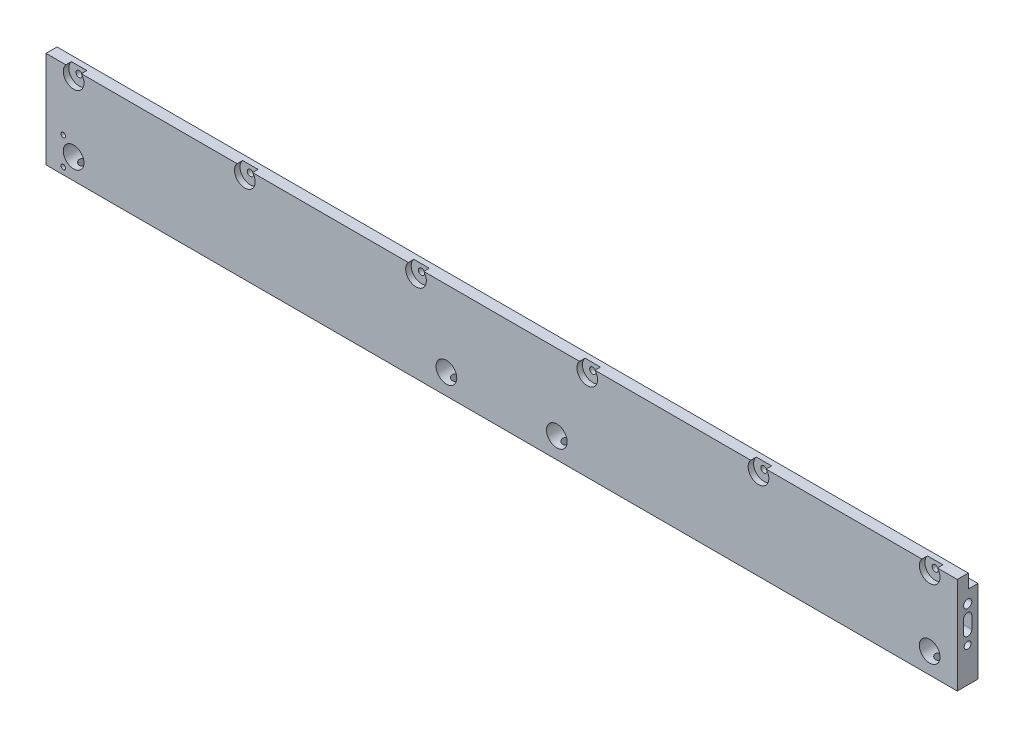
SolidWorks part; units mm, degrees
ref_plane "Plan de face" through (0, 0, 0) normal (0, 0, 1) x (1, 0, 0)
ref_plane "Plan de dessus" through (0, 0, 0) normal (0, 1, 0) x (1, 0, 0)
ref_plane "Plan de droite" through (0, 0, 0) normal (1, 0, 0) x (0, 0, -1)
sketch "Esquisse1" plane through (0, 0, 0) normal (1, 0, 0) x (0, 0, -1)
  line L0 (0, 0) -> (0, 70)
  line L1 (0, 70) -> (8, 70)
  line L2 (8, 70) -> (8, 60)
  line L3 (8, 60) -> (15, 60)
  line L4 (15, 60) -> (15, 0)
  line L5 (15, 0) -> (0, 0)
  dimension "D1" = 70
  dimension "D2" = 60
  dimension "D3" = 8
  dimension "D4" = 15
extrude "Extrusion1" add sketch "Esquisse1" along normal mid plane 660
hole_wizard "Dégagement M61" positions "Esquisse3" profile "Esquisse2" hole size "M6" standard "ISO"
sketch "Esquisse3" plane through (0, 0, -15) normal (0, 0, -1) x (-1, 0, 0)
  line L1 (-330, 0) -> (-330, 60) construction
  line L2 (-330, 0) -> (330, 0) construction
  point P0 (-310, 15)
  point P1 (-40, 15)
  point P2 (40, 15)
  point P3 (310, 15)
  dimension "D1" = 20
  dimension "D2" = 290
  dimension "D3" = 370
  dimension "D4" = 640
  dimension "D5" = 15
sketch "Esquisse2" plane through (310, 15, -15) normal (1, 0, 0) x (0, 1, 0)
  line L0 (0, 0) -> (0, 64.5065)
  line L1 (0, 64.5065) -> (7.5, 60)
  line L2 (7.5, 60) -> (7.5, 0)
  line L5 (7.5, 0) -> (0, 0)
  line L10 (0, 64.5065) -> (-7.5, 60) construction
  line L11 (0, -6.35) -> (0, 107.95) construction
  dimension "Diamètre du perçage" = 15
  dimension "Profondeur du perçage" = 60
  dimension "Angle de pointe" = 118
hole_wizard "Dégagement M62" positions "Esquisse5" profile "Esquisse4" hole size "M6" standard "ISO"
sketch "Esquisse5" plane through (0, 0, 0) normal (0, -1, 0) x (1, 0, 0)
  line L0 (-330, 0) -> (-330, -15) construction
  line L1 (330, -15) -> (-330, -15) construction
  point P0 (310, -7.5)
  point P1 (40, -7.5)
  point P2 (-40, -7.5)
  point P3 (-310, -7.5)
  dimension "D1" = 20
  dimension "D2" = 290
  dimension "D3" = 370
  dimension "D4" = 640
  dimension "D5" = 7.5
sketch "Esquisse4" plane through (310, 0, -7.5) normal (1, 0, 0) x (0, 0, -1)
  line L0 (0, 0) -> (0, 7.5)
  line L1 (0, 7.5) -> (3.25, 7.5)
  line L2 (3.25, 7.5) -> (3.25, 0)
  line L5 (3.25, 0) -> (0, 0)
  line L11 (0, -6.35) -> (0, 107.95) construction
  dimension "Diamètre du perçage jusqu'au prochain" = 6.5
  dimension "Profondeur du perçage jusqu'au prochain" = 7.5
hole_wizard "Trou taraudé M6x1.01" positions "Esquisse7" profile "Esquisse6" tap size "M6x1.0" standard "ISO"
sketch "Esquisse7" plane through (330, 0, 0) normal (1, 0, 0) x (0, 0, -1)
  line L0 (0, 0) -> (15, 0) construction
  line L1 (15, 0) -> (15, 60) construction
  point P0 (7.5, 25)
  dimension "D1" = 25
  dimension "D2" = 7.5
sketch "Esquisse6" plane through (330, 25, -7.5) normal (0, 1, 0) x (0, 0, -1)
  line L0 (0, 0) -> (0, 19.5022)
  line L1 (0, 19.5022) -> (2.5, 18)
  line L2 (2.5, 18) -> (2.5, 0)
  line L5 (2.5, 0) -> (0, 0)
  line L10 (0, 19.5022) -> (-2.5, 18) construction
  line L11 (0, -6.35) -> (0, 107.95) construction
  dimension "Diamètre du trou pour taraudage" = 5
  dimension "Profondeur du trou pour taraudage" = 18
  dimension "Angle de pointe" = 118
hole_wizard "Trou taraudé M4x0.71" positions "Esquisse9" profile "Esquisse8" tap size "M4x0.7" standard "ISO"
sketch "Esquisse9" plane through (0, 0, -15) normal (0, 0, -1) x (-1, 0, 0)
  line L0 (-330, 0) -> (330, 0) construction
  line L1 (-330, 0) -> (-330, 60) construction
  point P0 (317.5, 25)
  point P1 (317.5, 5)
  dimension "D1" = 5
  dimension "D2" = 20
  dimension "D3" = 647.5
sketch "Esquisse8" plane through (-317.5, 25, -15) normal (1, 0, 0) x (0, 1, 0)
  line L0 (0, 0) -> (0, 15)
  line L1 (0, 15) -> (1.65, 15)
  line L2 (1.65, 15) -> (1.65, 0)
  line L5 (1.65, 0) -> (0, 0)
  line L11 (0, -6.35) -> (0, 107.95) construction
  dimension "Diamètre du trou pour taraudage jusqu'au prochain" = 3.3
  dimension "Profondeur du trou pour taraudage jusqu'au prochain" = 15
hole_wizard "Chambrage pour vis à tête hexagonale M61" positions "Esquisse11" profile "Esquisse10" counterbore size "M6" standard "ISO"
sketch "Esquisse11" plane through (0, 0, 0) normal (0, 0, 1) x (1, 0, 0)
  line L0 (330, 70) -> (330, 0) construction
  line L1 (330, 70) -> (-330, 70) construction
  point P0 (186, 65)
  point P1 (310, 65)
  point P2 (62, 65)
  point P3 (-62, 65)
  point P4 (-186, 65)
  point P5 (-310, 65)
  dimension "D1" = 20
  dimension "D2" = 144
  dimension "D3" = 268
  dimension "D4" = 392
  dimension "D5" = 516
  dimension "D6" = 640
  dimension "D7" = 5
sketch "Esquisse10" plane through (186, 65, 0) normal (1, 0, 0) x (0, -1, 0)
  line L0 (0, 0) -> (0, 15)
  line L1 (0, 15) -> (2.25, 15)
  line L3 (2.25, 15) -> (2.25, 4)
  line L4 (2.25, 4) -> (7.5, 4)
  line L5 (7.5, 4) -> (7.5, 0)
  line L7 (7.5, 0) -> (0, 0)
  line L11 (0, -6.35) -> (0, 107.95) construction
  dimension "Diamètre du perçage jusqu'au prochain" = 4.5
  dimension "Profondeur du perçage jusqu'au prochain" = 15
  dimension "Diamètre du chambrage" = 15
  dimension "Profondeur du chambrage" = 4
sketch "Esquisse12" plane through (-330, 0, 0) normal (-1, 0, 0) x (0, 0, 1)
  line L0 (-10.5, 33.5) -> (-10.5, 42.5)
  line L1 (-4.5, 42.5) -> (-4.5, 33.5)
  line L3 (-15, 0) -> (-15, 60) construction
  line L4 (-10.5, 38) -> (-4.5, 38) construction
  arc A0 (-10.5, 42.5) -> (-4.5, 42.5) centre (-7.5, 42.5) cw
  arc A1 (-4.5, 33.5) -> (-10.5, 33.5) centre (-7.5, 33.5) cw
  circle A2 centre (-7.5, 51) radius 3
  dimension "D1" = 15
  dimension "D3" = 38
  dimension "D5" = 6
  dimension "D2" = 6
  dimension "D4" = 7.5
  dimension "D6" = 13
extrude "Enlèv. mat.-Extru.1" cut sketch "Esquisse12" against normal up to next
hole_wizard "Trou taraudé M6x1.03" positions "Esquisse3D2" profile "Esquisse14" tap size "M6x1.0" standard "ISO"
sketch3d "Esquisse3D2"
  line L0 (-330, 0, -15) -> (-330, 60, -15) construction
  line L1 (-330, 0, 0) -> (-330, 0, -15) construction
  point P0 (-330, 25, -7.5)
  point P1 (-330, 5, -7.5)
  dimension "D1" = 7.5
  dimension "D2" = 5
  dimension "D3" = 20
sketch "Esquisse14" plane through (-330, 25, -7.5) normal (0, 1, 0) x (0, 0, 1)
  line L0 (0, 0) -> (0, 10.5022)
  line L1 (0, 10.5022) -> (2.5, 9)
  line L2 (2.5, 9) -> (2.5, 0)
  line L5 (2.5, 0) -> (0, 0)
  line L10 (0, 10.5022) -> (-2.5, 9) construction
  line L11 (0, -6.35) -> (0, 107.95) construction
  dimension "Diamètre du trou pour taraudage" = 5
  dimension "Profondeur du trou pour taraudage" = 9
  dimension "Angle de pointe" = 118
